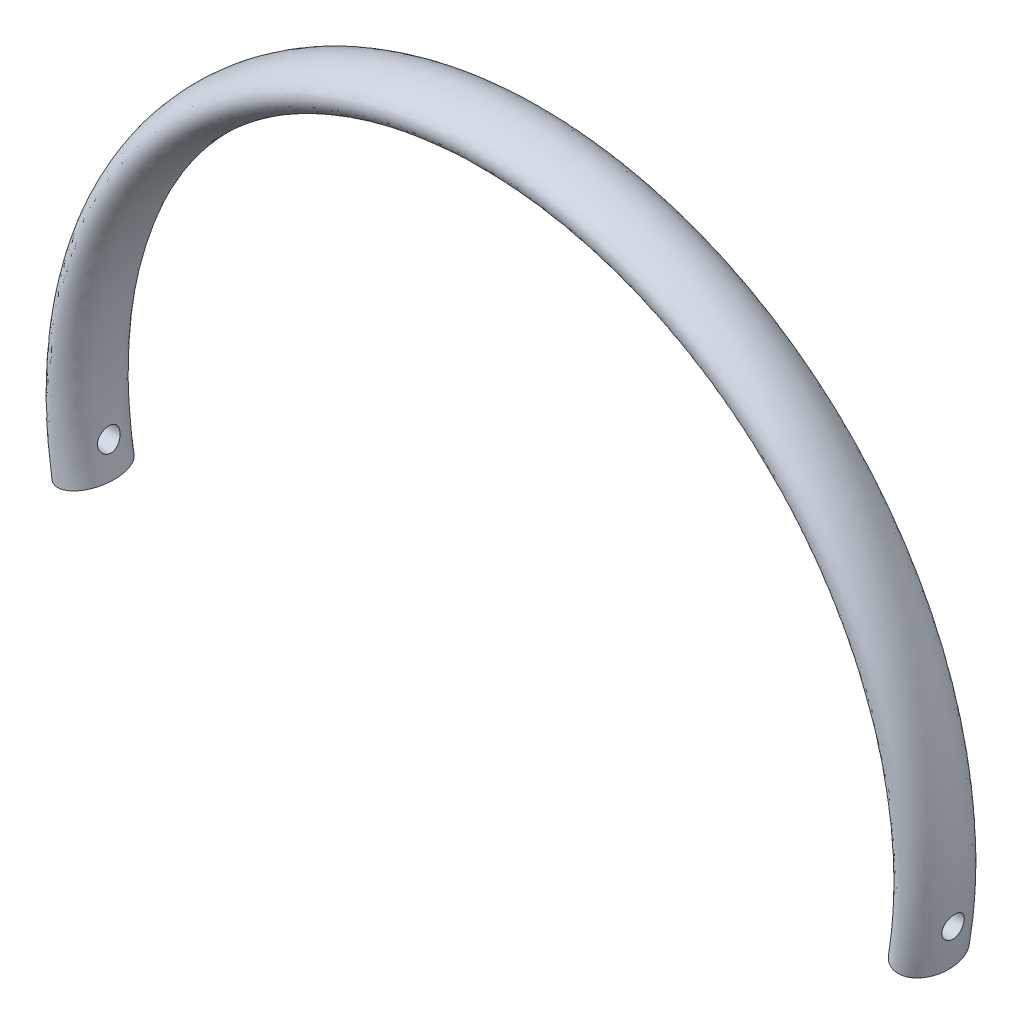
SolidWorks part; units mm, degrees
ref_plane "X Y" through (0, 0, 0) normal (0, 0, 1) x (1, 0, 0)
ref_plane "X Z" through (0, 0, 0) normal (0, 1, 0) x (1, 0, 0)
ref_plane "Y Z" through (0, 0, 0) normal (1, 0, 0) x (0, 0, -1)
sketch "Sketch1" plane through (0, 0, 0) normal (0, 0, 1) x (1, 0, 0)
  line L0 (0, -265.3143) -> (0, 265.3143) construction
  line L1 (50, 0) -> (-50, 0) construction
  arc A0 (-751.3421, 0) -> (751.3421, 0) centre (0, 127) cw
  dimension "D1" = 762
  dimension "D2" = 127
sketch "Sketch2" plane through (0, 0, 0) normal (0, 1, 0) x (1, 0, 0)
  ellipse E0 centre (-751.3421, 0) end of major axis (-751.3421, 63.5) minor radius 38.1
  dimension "D1" = 76.2
  dimension "D2" = 127
sweep "Base-Sweep" add profiles "Sketch2" path "Sketch1"
sketch "Sketch3" plane through (0, 0, 0) normal (1, 0, 0) x (0, 0, -1)
  line L1 (0, 50) -> (0, -50) construction
  circle A0 centre (0, 58.4412) radius 20.1788
  dimension "D1" = 40.3576
  dimension "D2" = 58.4412
extrude "Cut-Extrude1" cut sketch "Sketch3" against normal through all and the other way through all
